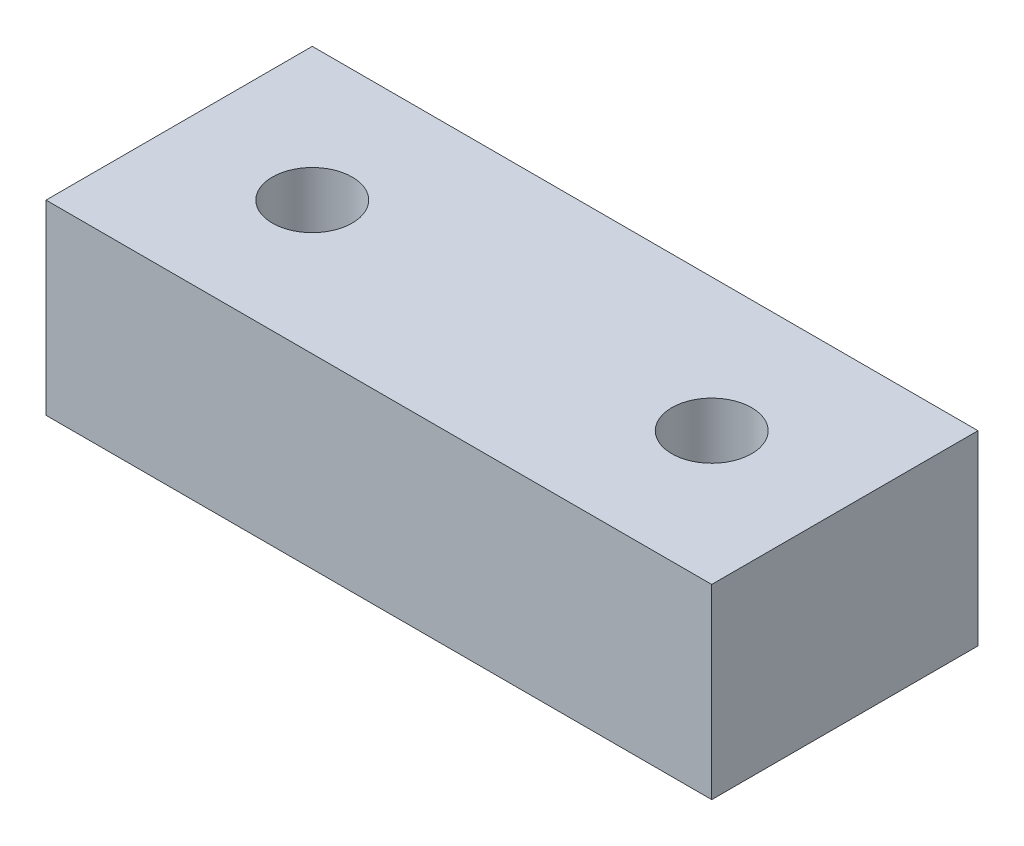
SolidWorks part; units mm, degrees
ref_plane "Plan1" through (0, 0, 0) normal (0, 0, 1) x (1, 0, 0)
ref_plane "plan2" through (0, 0, 0) normal (0, 1, 0) x (1, 0, 0)
ref_plane "Plan3" through (0, 0, 0) normal (1, 0, 0) x (0, 0, -1)
sketch "Esquisse1" plane through (0, 0, 0) normal (0, 0, 1) x (1, 0, 0)
  line L0 (0, -10) -> (0, 51) construction
  line L3 (0, 6) -> (25, 6)
  line L4 (0, 6) -> (-25, 6)
  line L5 (25, 6) -> (25, 20)
  line L6 (-25, 6) -> (-25, 20)
  line L7 (25, 20) -> (-25, 20)
  point P11 (0, 20)
  dimension "D3" = 14
  dimension "D4" = 50
extrude "Base-Extrusion" add sketch "Esquisse1" along normal blind 20
hole_wizard "Perçage1" positions "Esquisse2" profile "Esquisse3" legacy
sketch "Esquisse2" plane through (0, 6, 0) normal (0, -1, 0) x (1, 0, 0)
  line L0 (25, 20) -> (25, 0) construction
  line L1 (-25, 20) -> (25, 20) construction
  point P0 (15, 10)
  dimension "D1" = 10
  dimension "D2" = 10
sketch "Esquisse3" plane through (15, 6, 10) normal (1, 0, 0) x (0, 0, -1)
  line L0 (0, 0) -> (0, 15.8026)
  line L1 (0, 15.8026) -> (3, 14)
  line L2 (3, 14) -> (3, 2.5)
  line L3 (3, 2.5) -> (5.5, 0)
  line L4 (5.5, 0) -> (0, 0)
  line L5 (0, -14.3089) -> (0, 102.4216) construction
  line L6 (0, 15.8026) -> (-3, 14) construction
  line L7 (-3, 2.5) -> (-5.5, 0) construction
  dimension "Diamètre" = 6
  dimension "Profondeur" = 14
  dimension "Diamètre C-Sink" = 11
  dimension "Angle C-Sink" = 90
  dimension "Angle Drill" = 118
mirror "Symétrie2" about plane through (0, 0, 0) normal (1, 0, 0)
